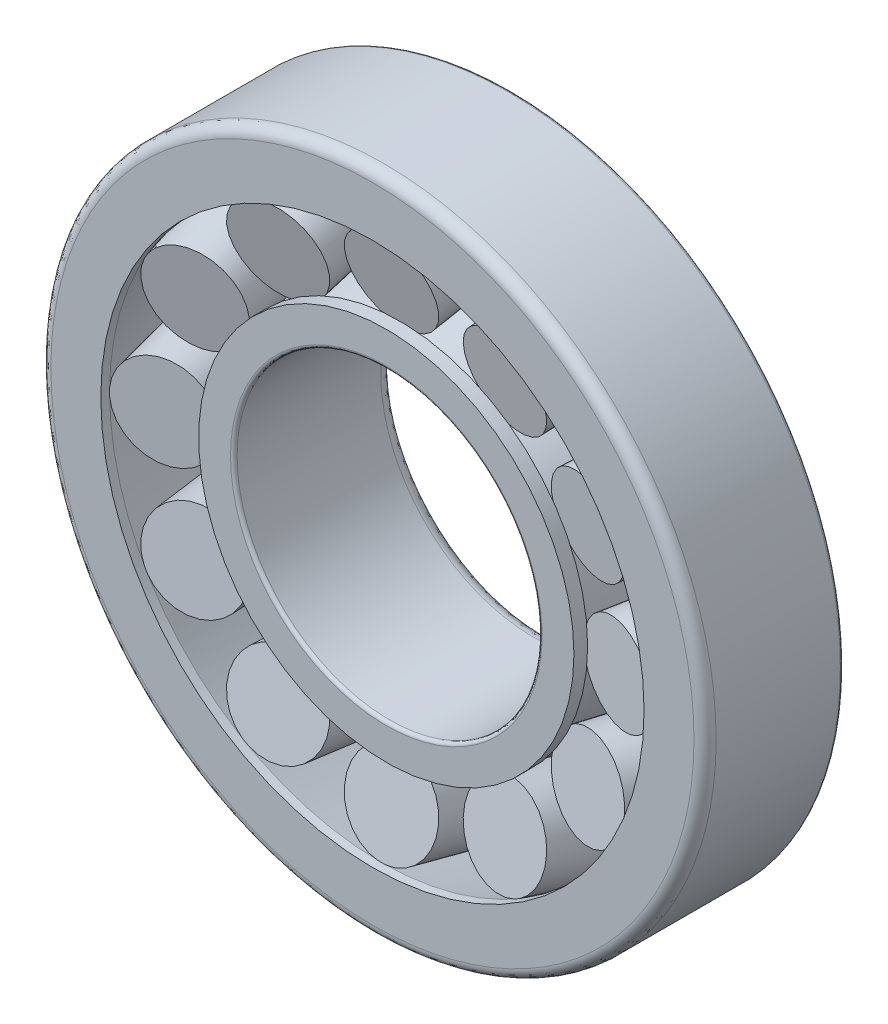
SolidWorks part; units mm, degrees
ref_plane "Front Plane" through (0, 0, 0) normal (0, 0, 1) x (1, 0, 0)
ref_plane "Top Plane" through (0, 0, 0) normal (0, 1, 0) x (1, 0, 0)
ref_plane "Right Plane" through (0, 0, 0) normal (1, 0, 0) x (0, 0, -1)
sketch "BaseSke" plane through (0, 0, 0) normal (1, 0, 0) x (0, 0, -1)
  line L0 (-47.2296, 0) -> (24.6132, 0) construction
  line L2 (0, 129.5214) -> (0, -86.3012) construction
  line L3 (4.5994, 48.448) -> (-36.0994, 39.052) construction
  line L4 (-31.5, 60) -> (-6.5, 60) construction
  line L5 (-29, 27.5) -> (0, 27.5) construction
  line L6 (-15.75, 43.75) -> (-21.8392, 70.1254) construction
  line L7 (-29.925, 49.0195) -> (-8.075, 54.6703)
  line L8 (-8.075, 54.6703) -> (-6.0698, 45.9848)
  line L9 (-6.0698, 45.9848) -> (-28.0527, 40.9097)
  line L10 (-28.0527, 40.9097) -> (-29.925, 49.0195)
  line L11 (-31.5, 60) -> (-31.5, 49) construction
  line L12 (-29.9205, 49) -> (-6.5, 55.057) construction
  line L13 (-6.5, 60) -> (-6.5, 55.057) construction
  line L14 (-29.9205, 49) -> (-31.5, 49) construction
  line L15 (-26.1804, 32.7999) -> (-4.0646, 37.2994) construction
  line L16 (-29, 27.5) -> (-29, 33.8499) construction
  line L17 (-29, 33.8499) -> (-26.5255, 33.8499) construction
  line L18 (0, 38.3494) -> (0, 27.5) construction
  line L19 (-26.5255, 33.8499) -> (-26.2897, 32.8287) construction
  line L20 (-26.2897, 32.8287) -> (-3.9778, 37.3681) construction
  line L21 (-3.9778, 37.3681) -> (-4.2044, 38.3494) construction
  line L22 (-4.2044, 38.3494) -> (0, 38.3494) construction
  dimension "D2" = 15.75
  dimension "D1" = 0.02
  dimension "Outer_Thickness" = 25
  dimension "Bearing_Outside_Diameter" = 120
  dimension "Bearing_Inside_Diameter" = 55
  dimension "Inner_Thickness" = 29
  dimension "Bearing_Thickness" = 31.5
  dimension "Angle" = 13
  dimension "D3" = 87.5
  dimension "D4" = 1.575
  dimension "D5" = 1.575
  dimension "D6" = 1.5
  dimension "D7" = 0.1
  dimension "Roller_diameter" = 98
  dimension "D8" = 1.05
  dimension "D9" = 0.05
  dimension "D10" = 0.1
  dimension "D11" = 1.05
revolve "Roller" add sketch "BaseSke" angle 360 about L3
sketch "OuterRaceSke" plane through (0, 0, 0) normal (1, 0, 0) x (0, 0, -1)
  line L0 (-29.9205, 49) -> (-31.5, 49) construction
  line L1 (-29.9205, 49) -> (-6.5, 55.057) construction
  line L2 (-6.5, 60) -> (-6.5, 55.057) construction
  line L3 (-31.5, 60) -> (-6.5, 60) construction
  line L4 (-31.5, 60) -> (-31.5, 49) construction
  line L5 (-29.9205, 49) -> (-31.5, 49)
  line L6 (-29.9205, 49) -> (-6.5, 55.057)
  line L7 (-6.5, 60) -> (-6.5, 55.057)
  line L8 (-31.5, 60) -> (-6.5, 60)
  line L9 (-31.5, 60) -> (-31.5, 49)
  line L10 (-60.3939, 0) -> (35.9926, 0) construction
revolve "OuterRace" add sketch "OuterRaceSke" angle 360 about L10
sketch "InnerRaceSke" plane through (0, 0, 0) normal (1, 0, 0) x (0, 0, -1)
  line L0 (-29, 27.5) -> (0, 27.5) construction
  line L1 (-29, 27.5) -> (-29, 33.8499) construction
  line L2 (-29, 33.8499) -> (-26.5255, 33.8499) construction
  line L3 (-26.5255, 33.8499) -> (-26.2897, 32.8287) construction
  line L4 (-26.2897, 32.8287) -> (-3.9778, 37.3681) construction
  line L5 (-3.9778, 37.3681) -> (-4.2044, 38.3494) construction
  line L6 (-4.2044, 38.3494) -> (0, 38.3494) construction
  line L7 (0, 38.3494) -> (0, 27.5) construction
  line L8 (-29, 27.5) -> (0, 27.5)
  line L9 (-29, 27.5) -> (-29, 33.8499)
  line L10 (-29, 33.8499) -> (-26.5255, 33.8499)
  line L11 (-26.5255, 33.8499) -> (-26.2897, 32.8287)
  line L12 (-26.2897, 32.8287) -> (-3.9778, 37.3681)
  line L13 (-3.9778, 37.3681) -> (-4.2044, 38.3494)
  line L14 (-4.2044, 38.3494) -> (0, 38.3494)
  line L15 (0, 38.3494) -> (0, 27.5)
  line L16 (-58.1022, 0) -> (39.538, 0) construction
revolve "InnerRace" add sketch "InnerRaceSke" angle 360 about L16
fillet "Fillet1" radius 0.6 2 edges at (60, 0, 6.5) (27.5, 0, 29)
fillet "InnerFillet" radius 2.5 1 edges at (27.5, 0, 0)
fillet "OuterFillet" radius 2 1 edges at (60, 0, 31.5)
pattern_circular "CirPatternBall" count 12 over 360 about axis through (0, 0, 0) along (0, 0, 1) of "Roller"
sketch "Sketch4" plane through (0, 0, 0) normal (1, 0, 0) x (0, 0, -1)
  line L0 (-29.925, 49.0195) -> (-8.075, 54.6703)
  line L1 (-8.075, 54.6703) -> (-4.0646, 37.2994)
  line L2 (-4.0646, 37.2994) -> (-26.1804, 32.7999)
  line L3 (-26.1804, 32.7999) -> (-29.925, 49.0195)
  line L4 (-40.3293, 0) -> (19.5574, 0) construction
revolve "Simplified" [suppressed] add sketch "Sketch4" angle 360 about L4
equation "\"D2@BaseSke\" = \"Bearing_Thickness@BaseSke\"/2"
equation "\"D3@BaseSke\" =  ( \"Bearing_Outside_Diameter@BaseSke\" + \"Bearing_Inside_Diameter@BaseSke\" )  / 2"
equation "\"Roller_diameter@BaseSke\" = \"D3@BaseSke\"*1.12"
equation "\"D4@BaseSke\" = \"Bearing_Thickness@BaseSke\"/20"
equation "\"D5@BaseSke\" = \"Bearing_Thickness@BaseSke\" / 20"
equation "\"D8@BaseSke\" = \"Bearing_Thickness@BaseSke\"/30"
equation "\"D11@BaseSke\" = \"D8@BaseSke\""
equation "\"D1@CirPatternBall\" = int(  \"D3@BaseSke\" *  pi  /  ( \"Bearing_Outside_Diameter@BaseSke\" - \"Bearing_Inside_Diameter@BaseSke\" )  * 3 ) "
